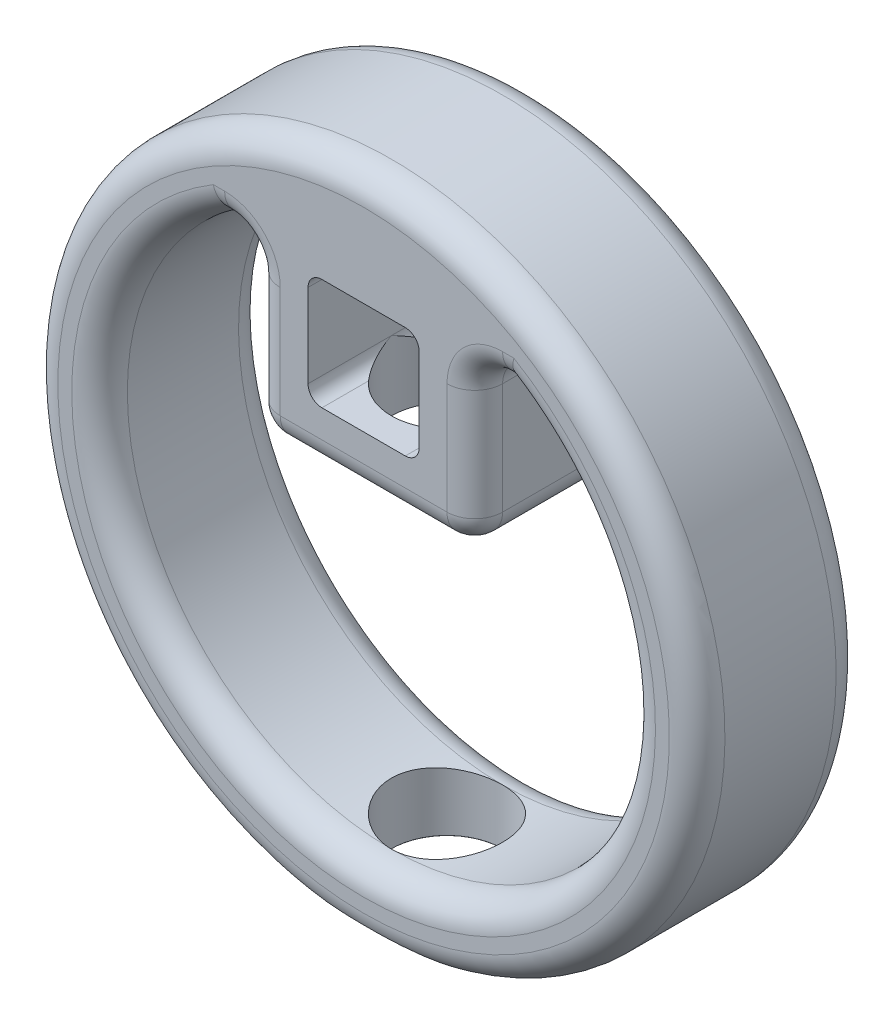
SolidWorks part; units mm, degrees
ref_plane "Front Plane" through (0, 0, 0) normal (0, 0, 1) x (1, 0, 0)
ref_plane "Top Plane" through (0, 0, 0) normal (0, 1, 0) x (1, 0, 0)
ref_plane "Right Plane" through (0, 0, 0) normal (1, 0, 0) x (0, 0, -1)
sketch "Sketch1" plane through (0, 0, 0) normal (0, 0, 1) x (1, 0, 0)
  line L0 (-3.6639, -0.7326) -> (4.3361, -0.7326) construction
  line L5 (-2.6639, 3.2674) -> (3.3361, 3.2674)
  line L6 (-3.6639, 2.2674) -> (-3.6639, -3.7326)
  line L7 (-2.6639, -4.7326) -> (3.3361, -4.7326)
  line L8 (4.3361, 2.2674) -> (4.3361, -3.7326)
  line L9 (0.3361, 3.2674) -> (0.3361, -4.7326) construction
  line L10 (-9.6639, 3.2674) -> (-9.9108, 3.2674)
  line L12 (-7.6639, 1.2674) -> (-7.6639, -6.7326)
  line L13 (-5.6639, -8.7326) -> (6.3361, -8.7326)
  line L14 (8.3361, 1.2674) -> (8.3361, -6.7326)
  line L15 (-3.371, 2.9745) -> (8.3361, -8.7326) construction
  line L16 (-7.6639, -8.7326) -> (4.0432, 2.9745) construction
  line L17 (10.3361, 3.2674) -> (10.5831, 3.2674)
  line L18 (-6.5195, -35.7326) -> (7.1918, -35.7326)
  arc A0 (-3.6639, -3.7326) -> (-2.6639, -4.7326) centre (-2.6639, -3.7326) ccw
  arc A1 (3.3361, -4.7326) -> (4.3361, -3.7326) centre (3.3361, -3.7326) ccw
  arc A2 (3.3361, 3.2674) -> (4.3361, 2.2674) centre (3.3361, 2.2674) cw
  arc A3 (-2.6639, 3.2674) -> (-3.6639, 2.2674) centre (-2.6639, 2.2674) ccw
  arc A4 (7.1918, -35.7326) -> (-6.5195, -35.7326) centre (0.3361, -12.7326) ccw
  arc A5 (-9.9108, 3.2674) -> (10.5831, 3.2674) centre (0.3361, -12.7326) ccw
  arc A6 (6.3361, -8.7326) -> (8.3361, -6.7326) centre (6.3361, -6.7326) ccw
  arc A7 (-7.6639, -6.7326) -> (-5.6639, -8.7326) centre (-5.6639, -6.7326) ccw
  arc A8 (10.3361, 3.2674) -> (8.3361, 1.2674) centre (10.3361, 1.2674) ccw
  arc A9 (-9.6639, 3.2674) -> (-7.6639, 1.2674) centre (-9.6639, 1.2674) cw
  point P0 (0, 0)
  point P20 (0.3361, -0.7326)
  point P22 (0.3361, -0.7326)
  dimension "D1" = 1
  dimension "D4" = 48
  dimension "D6" = 5
  dimension "D7" = 2
  dimension "D2" = 8
  dimension "D3" = 8
  dimension "D5" = 12
  dimension "D8" = 4
  dimension "D9" = 4
  dimension "D10" = 4
  dimension "D11" = 23
extrude "Boss-Extrude1" add sketch "Sketch1" along normal blind 12
fillet "Fillet1" radius 2 4 edges at (0.3361, -31.7326, 0) (0.3361, -31.7326, 12) (0.3361, 11.2674, 12) (0.3361, 11.2674, 0)
fillet "Fillet2" radius 2 18 edges at (12.1369, 3.2674, 12) (8.9219, 2.6816, 12) (8.3361, -2.7326, 12) (7.7504, -8.1468, 12) (-11.4646, 3.2674, 12) (-8.2496, 2.6816, 12) (-7.6639, -2.7326, 12) (-7.0781, -8.1468, 12) (8.9219, 2.6816, 0) (-11.4646, 3.2674, 0) (-8.2496, 2.6816, 0) (-7.6639, -2.7326, 0) (-7.0781, -8.1468, 0) (0.3361, -8.7326, 12) (12.1369, 3.2674, 0) (7.7504, -8.1468, 0) (8.3361, -2.7326, 0) (0.3361, -8.7326, 0)
sketch "Sketch4" plane through (0, -35.7326, 0) normal (0, -1, 0) x (1, 0, 0)
  line L0 (-6.5195, 6) -> (7.1918, 6) construction
  line L1 (-6.5195, 10) -> (-6.5195, 2) construction
  line L2 (7.1918, 10) -> (7.1918, 2) construction
  line L3 (0.3361, 11.7321) -> (0.3361, 0.2679) construction
  circle A0 centre (0.3361, 6) radius 4
  spline S0 degree 3 poles (7.1918, 10) (7.1918, 10.1591) (7.123, 10.3076) (6.9274, 10.5549) (6.8057, 10.6543) (6.544, 10.8286) (6.4063, 10.9008) (6.1245, 11.0286) (5.9799, 11.0839) (5.5392, 11.2328) (5.236, 11.3094) (4.6311, 11.4351) (4.3271, 11.4845) (3.4125, 11.6072) (2.7992, 11.6557) (1.5687, 11.7185) (0.9507, 11.7321) (-0.2834, 11.732) (-0.8997, 11.7184) (-2.1307, 11.6555) (-2.7454, 11.6069) (-3.6648, 11.483) (-3.9701, 11.4331) (-4.5727, 11.3072) (-4.8707, 11.2317) (-5.3084, 11.0836) (-5.4527, 11.0284) (-5.7364, 10.8996) (-5.8754, 10.8264) (-6.1355, 10.6527) (-6.2567, 10.5533) (-6.4506, 10.3075) (-6.5195, 10.157) (-6.5195, 10) knots 0 0 0 0 0.03125 0.03125 0.0625 0.0625 0.09375 0.09375 0.125 0.125 0.1875 0.1875 0.25 0.25 0.375 0.375 0.5 0.5 0.625 0.625 0.75 0.75 0.8125 0.8125 0.875 0.875 0.90625 0.90625 0.9375 0.9375 0.96875 0.96875 1 1 1 1 construction
  spline S1 degree 3 poles (-6.5195, 2) (-6.5195, 1.8409) (-6.4507, 1.6924) (-6.2551, 1.4451) (-6.1335, 1.3457) (-5.8717, 1.1714) (-5.734, 1.0992) (-5.4522, 0.9714) (-5.3077, 0.9161) (-4.8669, 0.7672) (-4.5637, 0.6906) (-3.9588, 0.5649) (-3.6548, 0.5155) (-2.7403, 0.3928) (-2.1269, 0.3443) (-0.8964, 0.2815) (-0.2784, 0.2679) (0.9557, 0.268) (1.572, 0.2816) (2.803, 0.3445) (3.4176, 0.3931) (4.3371, 0.517) (4.6424, 0.5669) (5.245, 0.6928) (5.543, 0.7683) (5.9806, 0.9164) (6.125, 0.9716) (6.4087, 1.1004) (6.5477, 1.1736) (6.8078, 1.3473) (6.929, 1.4467) (7.1229, 1.6925) (7.1918, 1.843) (7.1918, 2) knots 0 0 0 0 0.03125 0.03125 0.0625 0.0625 0.09375 0.09375 0.125 0.125 0.1875 0.1875 0.25 0.25 0.375 0.375 0.5 0.5 0.625 0.625 0.75 0.75 0.8125 0.8125 0.875 0.875 0.90625 0.90625 0.9375 0.9375 0.96875 0.96875 1 1 1 1 construction
  point P12 (0.3361, 6)
  dimension "D2" = 8
  dimension "D1" = 0
hole_wizard "Ø8.0mm Clearance Dowel Hole1" positions "3DSketch1" profile "Sketch5" hole size "Ø8.0" standard "ISO"
sketch3d "3DSketch1"
  point P0 (0.3361, -35.7326, 6)
sketch "Sketch5" plane through (0.3361, -35.7326, 6) normal (1, 0, 0) x (0, 0, -1)
  line L0 (0, 0) -> (0, 37.4034)
  line L1 (0, 37.4034) -> (4, 35)
  line L2 (4, 35) -> (4, 0.0241)
  line L3 (4, 0.0241) -> (4.025, 0)
  line L5 (4.025, 0) -> (0, 0)
  line L6 (-4, 0.0241) -> (-4.025, 0) construction
  line L10 (0, 37.4034) -> (-4, 35) construction
  line L11 (0, -6.35) -> (0, 107.95) construction
  dimension "Hole Dia." = 8
  dimension "Hole Depth" = 35
  dimension "Near C'Sink Dia." = 8.05
  dimension "Near C'Sink Angle" = 92
  dimension "Drill Angle" = 118
